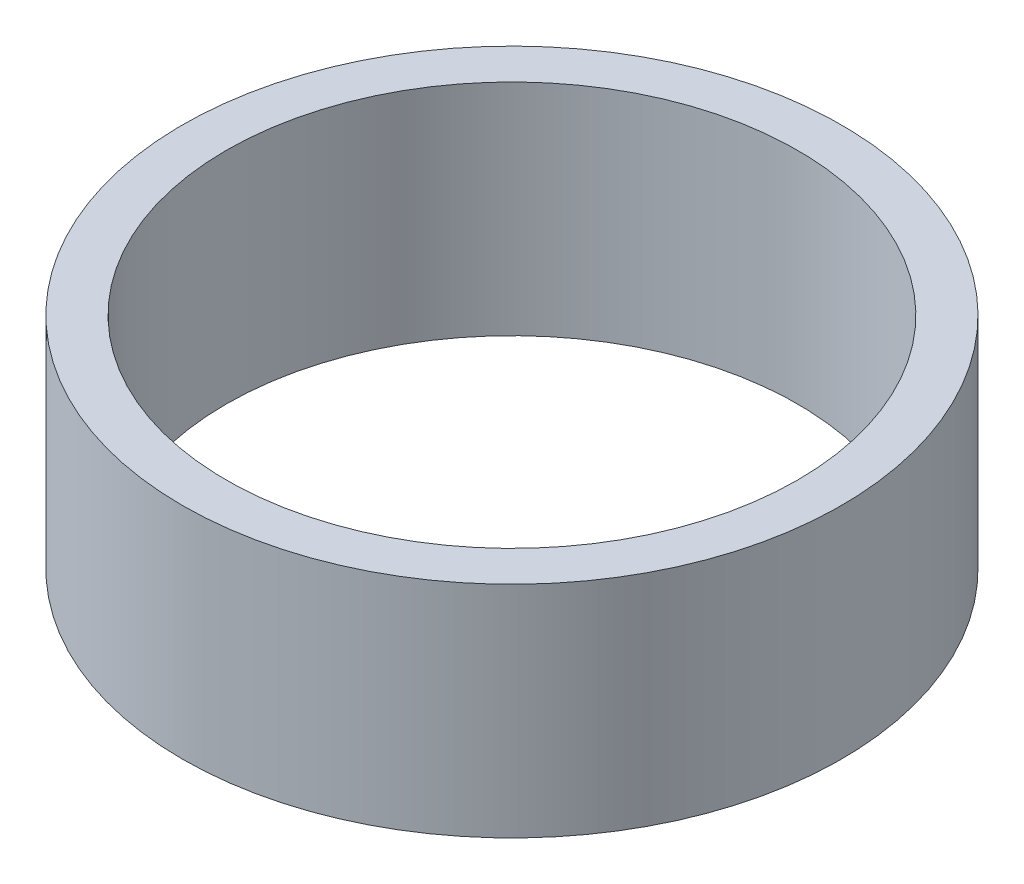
SolidWorks part; units mm, degrees
ref_plane "Front Plane" through (0, 0, 0) normal (0, 0, 1) x (1, 0, 0)
ref_plane "Top Plane" through (0, 0, 0) normal (0, 1, 0) x (1, 0, 0)
ref_plane "Right Plane" through (0, 0, 0) normal (1, 0, 0) x (0, 0, -1)
sketch "Sketch2" plane through (0, 0, 0) normal (0, 1, 0) x (1, 0, 0)
  circle A0 centre (0, 0) radius 15
extrude "Extrude-Thin1" add sketch "Sketch2" along normal blind 10 thin
